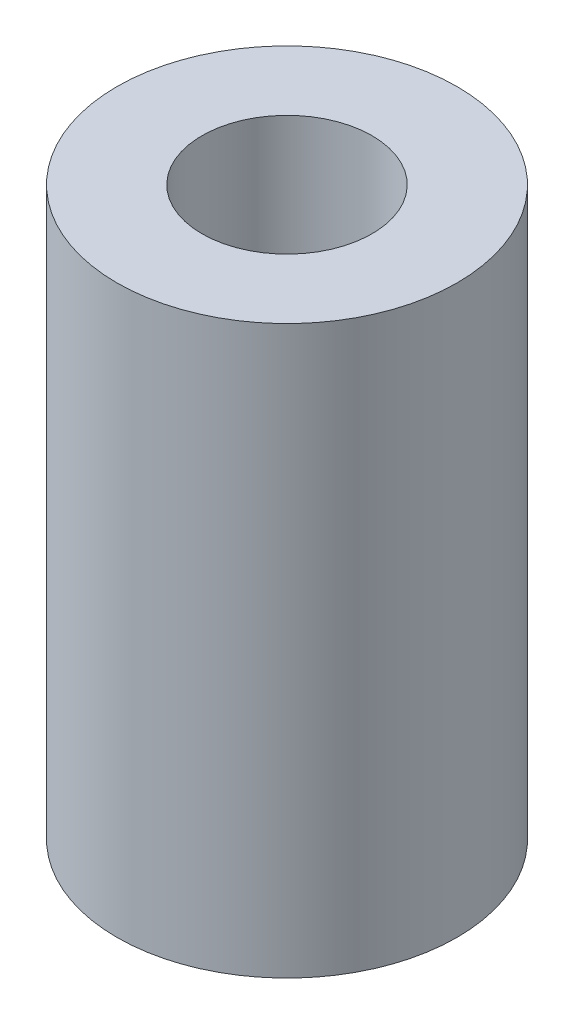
SolidWorks part; units mm, degrees
ref_plane "Plan de face" through (0, 0, 0) normal (0, 0, 1) x (1, 0, 0)
ref_plane "Plan de dessus" through (0, 0, 0) normal (0, 1, 0) x (1, 0, 0)
ref_plane "Plan de droite" through (0, 0, 0) normal (1, 0, 0) x (0, 0, -1)
sketch "Esquisse1" plane through (0, 0, 0) normal (0, 1, 0) x (1, 0, 0)
  circle A0 centre (0, 0) radius 1.5
  circle A1 centre (0, 0) radius 3
extrude "Extrusion1" add sketch "Esquisse1" along normal blind 10
